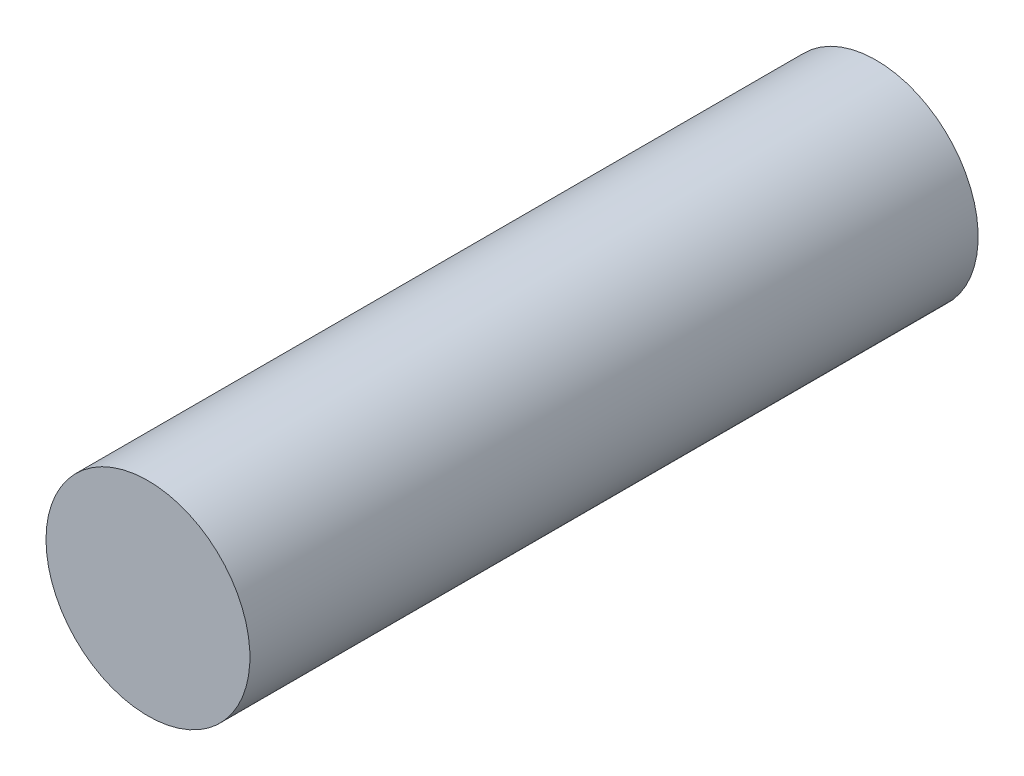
SolidWorks part; units mm, degrees
ref_plane "Front Plane" through (0, 0, 0) normal (0, 0, 1) x (1, 0, 0)
ref_plane "Top Plane" through (0, 0, 0) normal (0, 1, 0) x (1, 0, 0)
ref_plane "Right Plane" through (0, 0, 0) normal (1, 0, 0) x (0, 0, -1)
sketch "Sketch1" plane through (0, 0, 0) normal (0, 0, 1) x (1, 0, 0)
  circle A0 centre (0, 0) radius 10.668
  dimension "D1" = 21.336
extrude "Extrude1" add sketch "Sketch1" along normal blind 76.2
